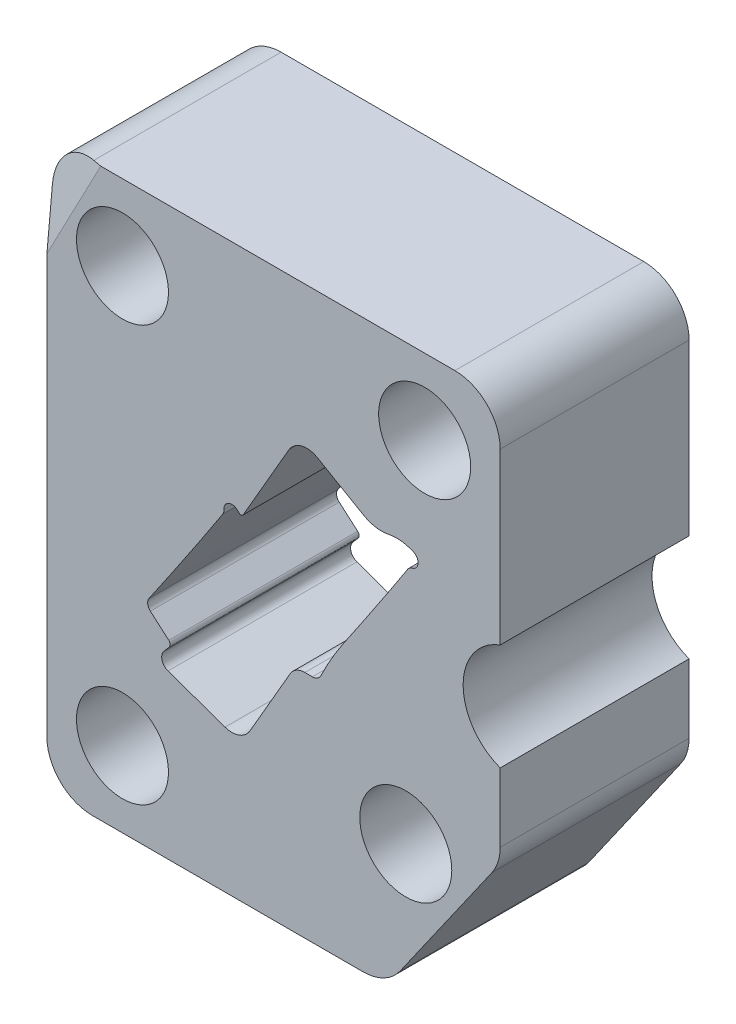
SolidWorks part; units mm, degrees
ref_plane "Front" through (0, 0, 0) normal (0, 0, 1) x (1, 0, 0)
ref_plane "Top" through (0, 0, 0) normal (0, 1, 0) x (1, 0, 0)
ref_plane "Right" through (0, 0, 0) normal (1, 0, 0) x (0, 0, -1)
ref_plane "Plane1"
sketch "Sketch1" plane through (0, 0, 0) normal (0, 0, 1) x (1, 0, 0)
  line L0 (-1085.85, 39.8243) -> (-1085.85, -16.9643) construction
  line L1 (-1116.33, 59.055) -> (-1055.37, 59.055)
  line L2 (-1123.95, 51.435) -> (-1123.95, -28.575)
  line L3 (-1116.33, -36.195) -> (-1070.8035, -36.195)
  line L4 (-1047.75, 51.435) -> (-1047.75, -6.5337)
  line L5 (-1071.9787, 11.43) -> (-1099.3643, 11.43) construction
  line L6 (-1095.375, -85.471) -> (-1095.375, 85.471) construction
  line L7 (-1055.624, 0) -> (-1095.375, 0) construction
  line L8 (-1035.177, 120.015) -> (-1035.177, 46.355) construction
  line L10 (-1064.5615, -32.9457) -> (-1049.1281, -10.9044)
  arc A0 (-1055.37, 59.055) -> (-1047.75, 51.435) centre (-1055.37, 51.435) cw
  arc A1 (-1123.95, -28.575) -> (-1116.33, -36.195) centre (-1116.33, -28.575) ccw
  arc A2 (-1116.33, 59.055) -> (-1123.95, 51.435) centre (-1116.33, 51.435) ccw
  arc A4 (-1047.75, -6.5337) -> (-1049.1281, -10.9044) centre (-1055.37, -6.5337) cw
  arc A5 (-1064.5615, -32.9457) -> (-1070.8035, -36.195) centre (-1070.8035, -28.575) cw
  point P8 (-1085.85, 11.43)
  point P18 (-1047.75, 59.055)
  point P25 (-1047.75, -36.195)
extrude "Boss-Extrude1" add sketch "Sketch1" against normal blind 31.75 flip side to cut
ref_plane "Plane2 QU250515L_Punch5[Mounted in the strip]-2"
ref_plane "Plane1 QU250515L_Punch5[Mounted in the strip]-2"
sketch "Sketch2 QU250515L_Punch5[Mounted in the strip]-2" plane through (0, 0, 0) normal (0, 0, 1) x (1, 0, 0)
  line L0 (-1080.5961, 2.8111) -> (-1079.3261, 2.8111)
  line L1 (-1090.0893, -10.4567) -> (-1083.3457, 1.2236)
  line L2 (-1103.4859, -8.4829) -> (-1093.8944, -11.8636)
  line L3 (-1103.1527, -5.4507) -> (-1104.0226, -6.4524)
  line L4 (-1106.3539, -1.325) -> (-1103.2536, -4.0174)
  line L5 (-1091.8285, 19.9313) -> (-1092.2112, 20.2654)
  line L6 (-1083.0064, 33.3938) -> (-1090.6675, 20.1244)
  line L7 (-1070.8651, 30.0502) -> (-1078.6693, 34.5559)
  line L8 (-1062.5436, 28.9295) -> (-1063.0227, 29.0983)
  line L9 (-1062.5436, 28.9295) -> (-1063.0227, 29.0983)
  line L10 (-1070.8651, 30.0502) -> (-1078.6693, 34.5559)
  line L11 (-1083.0064, 33.3938) -> (-1090.6675, 20.1244)
  line L12 (-1091.8285, 19.9313) -> (-1092.2112, 20.2654)
  line L13 (-1106.3539, -1.325) -> (-1103.2536, -4.0174)
  line L14 (-1103.1527, -5.4507) -> (-1104.0226, -6.4524)
  line L15 (-1103.4859, -8.4829) -> (-1093.8944, -11.8636)
  line L16 (-1090.0893, -10.4567) -> (-1083.3457, 1.2236)
  line L17 (-1080.5961, 2.8111) -> (-1079.3261, 2.8111)
  arc A0 (-1080.5961, 2.8111) -> (-1083.3457, 1.2236) centre (-1080.5961, -0.3639) ccw
  arc A1 (-1093.8944, -11.8636) -> (-1090.0893, -10.4567) centre (-1092.8389, -8.8692) ccw
  arc A2 (-1104.0226, -6.4524) -> (-1103.4859, -8.4829) centre (-1103.0637, -7.2851) ccw
  arc A3 (-1103.1527, -5.4507) -> (-1103.2536, -4.0174) centre (-1103.9198, -4.7845) ccw
  arc A4 (-1106.5212, -0.0019) -> (-1106.3539, -1.325) centre (-1105.6982, -0.57) ccw
  arc A5 (-1106.5212, -0.0019) -> (-1094.1094, 18.4881) centre (-1812.9205, 487.596) ccw
  arc A6 (-1094.1094, 18.4881) -> (-1093.866, 19.4364) centre (-1095.3856, 19.321) ccw
  arc A7 (-1092.2112, 20.2654) -> (-1093.866, 19.4364) centre (-1092.8689, 19.5121) ccw
  arc A8 (-1091.8285, 19.9313) -> (-1090.6675, 20.1244) centre (-1091.3274, 20.5054) ccw
  arc A9 (-1078.6693, 34.5559) -> (-1083.0064, 33.3938) centre (-1080.2568, 31.8063) ccw
  arc A10 (-1070.8651, 30.0502) -> (-1066.4119, 29.3295) centre (-1067.6901, 35.5495) ccw
  arc A11 (-1063.0227, 29.0983) -> (-1066.4119, 29.3295) centre (-1065.1336, 23.1095) ccw
  arc A12 (-1062.6359, 27.0156) -> (-1062.5436, 28.9295) centre (-1062.876, 27.9863) ccw
  arc A13 (-1062.6359, 27.0156) -> (-1063.5477, 26.3667) centre (-1062.2699, 25.5362) ccw
  arc A14 (-1074.4508, 10.0107) -> (-1063.5477, 26.3667) centre (-1773.1695, 487.596) ccw
  arc A15 (-1074.4508, 10.0107) -> (-1078.1838, 3.526) centre (-1030.0901, -19.8428) ccw
  arc A16 (-1079.3261, 2.8111) -> (-1078.1838, 3.526) centre (-1079.3261, 4.0811) ccw
  arc A17 (-1079.3261, 2.8111) -> (-1078.1838, 3.526) centre (-1079.3261, 4.0811) ccw
  arc A18 (-1074.4508, 10.0107) -> (-1078.1838, 3.526) centre (-1030.0901, -19.8428) ccw
  arc A19 (-1074.4508, 10.0107) -> (-1063.5477, 26.3667) centre (-1773.1695, 487.596) ccw
  arc A20 (-1062.6359, 27.0156) -> (-1063.5477, 26.3667) centre (-1062.2699, 25.5362) ccw
  arc A21 (-1062.6359, 27.0156) -> (-1062.5436, 28.9295) centre (-1062.876, 27.9863) ccw
  arc A22 (-1063.0227, 29.0983) -> (-1066.4119, 29.3295) centre (-1065.1336, 23.1095) ccw
  arc A23 (-1070.8651, 30.0502) -> (-1066.4119, 29.3295) centre (-1067.6901, 35.5495) ccw
  arc A24 (-1078.6693, 34.5559) -> (-1083.0064, 33.3938) centre (-1080.2568, 31.8063) ccw
  arc A25 (-1091.8285, 19.9313) -> (-1090.6675, 20.1244) centre (-1091.3274, 20.5054) ccw
  arc A26 (-1092.2112, 20.2654) -> (-1093.866, 19.4364) centre (-1092.8689, 19.5121) ccw
  arc A27 (-1094.1094, 18.4881) -> (-1093.866, 19.4364) centre (-1095.3856, 19.321) ccw
  arc A28 (-1106.5212, -0.0019) -> (-1094.1094, 18.4881) centre (-1812.9205, 487.596) ccw
  arc A29 (-1106.5212, -0.0019) -> (-1106.3539, -1.325) centre (-1105.6982, -0.57) ccw
  arc A30 (-1103.1527, -5.4507) -> (-1103.2536, -4.0174) centre (-1103.9198, -4.7845) ccw
  arc A31 (-1104.0226, -6.4524) -> (-1103.4859, -8.4829) centre (-1103.0637, -7.2851) ccw
  arc A32 (-1093.8944, -11.8636) -> (-1090.0893, -10.4567) centre (-1092.8389, -8.8692) ccw
  arc A33 (-1080.5961, 2.8111) -> (-1083.3457, 1.2236) centre (-1080.5961, -0.3639) ccw
  circle A34 centre (-1076.325, 25.4) radius 1.2065
  circle A35 centre (-1082.675, 17.4625) radius 5.3594
  circle A36 centre (-1090.6125, 3.175) radius 5.3594
  circle A52 centre (-1076.325, 25.4) radius 1.2065
  circle A56 centre (-1090.6125, 3.175) radius 5.3594
  circle A57 centre (-1082.675, 17.4625) radius 5.3594
sketch "Sketch1 QU250515L_Punch5[Mounted in the strip]-2" plane through (0, 0, -4.7625) normal (0, 0, 1) x (1, 0, 0)
  line L9 (-1080.5961, 2.491) -> (-1079.3261, 2.491)
  line L10 (-1062.4372, 29.2313) -> (-1062.9163, 29.4002)
  line L11 (-1070.7051, 30.3274) -> (-1078.5092, 34.8331)
  line L12 (-1083.2835, 33.5538) -> (-1090.9447, 20.2844)
  line L13 (-1091.6181, 20.1724) -> (-1092.0008, 20.5065)
  line L14 (-1106.5637, -1.5666) -> (-1103.4635, -4.259)
  line L15 (-1103.3943, -5.2408) -> (-1104.2643, -6.2426)
  line L16 (-1103.5923, -8.7848) -> (-1094.0008, -12.1655)
  line L17 (-1089.8122, -10.6167) -> (-1083.0686, 1.0635)
  line L18 (-1080.5961, 2.491) -> (-1079.3261, 2.491)
  line L19 (-1062.4372, 29.2313) -> (-1062.9163, 29.4002)
  line L20 (-1070.7051, 30.3274) -> (-1078.5092, 34.8331)
  line L21 (-1083.2835, 33.5538) -> (-1090.9447, 20.2844)
  line L22 (-1091.6181, 20.1724) -> (-1092.0008, 20.5065)
  line L23 (-1106.5637, -1.5666) -> (-1103.4635, -4.259)
  line L24 (-1103.3943, -5.2408) -> (-1104.2643, -6.2426)
  line L25 (-1103.5923, -8.7848) -> (-1094.0008, -12.1655)
  line L26 (-1089.8122, -10.6167) -> (-1083.0686, 1.0635)
  arc A17 (-1079.3261, 2.491) -> (-1077.896, 3.3861) centre (-1079.3261, 4.0811) ccw
  arc A18 (-1074.186, 9.8311) -> (-1077.896, 3.3861) centre (-1030.0901, -19.8428) ccw
  arc A19 (-1074.186, 9.8311) -> (-1063.2794, 26.1923) centre (-1773.1695, 487.596) ccw
  arc A20 (-1062.559, 26.7049) -> (-1063.2794, 26.1923) centre (-1062.2699, 25.5362) ccw
  arc A21 (-1062.559, 26.7049) -> (-1062.4372, 29.2313) centre (-1062.876, 27.9863) ccw
  arc A22 (-1062.9163, 29.4002) -> (-1066.4763, 29.643) centre (-1065.1336, 23.1095) ccw
  arc A23 (-1070.7051, 30.3274) -> (-1066.4763, 29.643) centre (-1067.6901, 35.5495) ccw
  arc A24 (-1078.5092, 34.8331) -> (-1083.2835, 33.5538) centre (-1080.2568, 31.8063) ccw
  arc A25 (-1091.6181, 20.1724) -> (-1090.9447, 20.2844) centre (-1091.3274, 20.5054) ccw
  arc A26 (-1092.0008, 20.5065) -> (-1094.1851, 19.4121) centre (-1092.8689, 19.5121) ccw
  arc A27 (-1094.3774, 18.663) -> (-1094.1851, 19.4121) centre (-1095.3856, 19.321) ccw
  arc A28 (-1106.7846, 0.1799) -> (-1094.3774, 18.663) centre (-1812.9205, 487.596) ccw
  arc A29 (-1106.7846, 0.1799) -> (-1106.5637, -1.5666) centre (-1105.6982, -0.57) ccw
  arc A30 (-1103.3943, -5.2408) -> (-1103.4635, -4.259) centre (-1103.9198, -4.7845) ccw
  arc A31 (-1104.2643, -6.2426) -> (-1103.5923, -8.7848) centre (-1103.0637, -7.2851) ccw
  arc A32 (-1094.0008, -12.1655) -> (-1089.8122, -10.6167) centre (-1092.8389, -8.8692) ccw
  arc A33 (-1080.5961, 2.491) -> (-1083.0686, 1.0635) centre (-1080.5961, -0.3639) ccw
  arc A34 (-1079.3261, 2.491) -> (-1077.896, 3.3861) centre (-1079.3261, 4.0811) ccw
  arc A35 (-1074.186, 9.8311) -> (-1077.896, 3.3861) centre (-1030.0901, -19.8428) ccw
  arc A36 (-1074.186, 9.8311) -> (-1063.2794, 26.1923) centre (-1773.1695, 487.596) ccw
  arc A37 (-1062.559, 26.7049) -> (-1063.2794, 26.1923) centre (-1062.2699, 25.5362) ccw
  arc A38 (-1062.559, 26.7049) -> (-1062.4372, 29.2313) centre (-1062.876, 27.9863) ccw
  arc A39 (-1062.9163, 29.4002) -> (-1066.4763, 29.643) centre (-1065.1336, 23.1095) ccw
  arc A40 (-1070.7051, 30.3274) -> (-1066.4763, 29.643) centre (-1067.6901, 35.5495) ccw
  arc A41 (-1078.5092, 34.8331) -> (-1083.2835, 33.5538) centre (-1080.2568, 31.8063) ccw
  arc A42 (-1091.6181, 20.1724) -> (-1090.9447, 20.2844) centre (-1091.3274, 20.5054) ccw
  arc A43 (-1092.0008, 20.5065) -> (-1094.1851, 19.4121) centre (-1092.8689, 19.5121) ccw
  arc A44 (-1094.3774, 18.663) -> (-1094.1851, 19.4121) centre (-1095.3856, 19.321) ccw
  arc A45 (-1106.7846, 0.1799) -> (-1094.3774, 18.663) centre (-1812.9205, 487.596) ccw
  arc A46 (-1106.7846, 0.1799) -> (-1106.5637, -1.5666) centre (-1105.6982, -0.57) ccw
  arc A47 (-1103.3943, -5.2408) -> (-1103.4635, -4.259) centre (-1103.9198, -4.7845) ccw
  arc A48 (-1104.2643, -6.2426) -> (-1103.5923, -8.7848) centre (-1103.0637, -7.2851) ccw
  arc A49 (-1094.0008, -12.1655) -> (-1089.8122, -10.6167) centre (-1092.8389, -8.8692) ccw
  arc A50 (-1080.5961, 2.491) -> (-1083.0686, 1.0635) centre (-1080.5961, -0.3639) ccw
sketch "Sketch2" plane through (0, 0, 0) normal (0, 0, 1) x (1, 0, 0)
  arc A2 (-1047.75, 5.0221) -> (-1047.75, 22.9179) centre (-1044.448, 13.97) ccw
  circle A3 centre (-1044.448, 13.97) radius 9.5377
  dimension "D1" = 0
extrude "Cut-Extrude1" cut sketch "Sketch2" against normal through all
ref_plane "Plane2" through (-36.348, 19.0606, 199.9142) normal (0.1781, -0.0934, -0.9796) x (-0.984, -0.0169, -0.1773)
other "SurfaceCut1"
hole_wizard "Hole1" positions "Point_Sketch" profile "Profil_Sketch" counterbore size "1/4" standard "ANSI Inch"
sketch "Point_Sketch" plane through (-1124.1191, -22.56, 0) normal (0, 0, -1) x (1, 0, 0)
  point P0 (12.8691, 0.935)
  point P2 (60.4941, -8.59)
  point P4 (63.6691, -68.915)
  point P6 (12.8691, -68.915)
sketch "Profil_Sketch" plane through (-1111.25, -23.495, 0) normal (1, 0, 0) x (0, -1, 0)
  line L0 (0, 0) -> (0, 31.75)
  line L1 (0, 31.75) -> (5.1562, 31.75)
  line L3 (5.1562, 31.75) -> (5.1562, 17.526)
  line L4 (5.1562, 17.526) -> (7.7343, 17.526)
  line L5 (7.7343, 17.526) -> (7.7343, 0)
  line L7 (7.7343, 0) -> (0, 0)
  line L11 (0, -6.35) -> (0, 107.95) construction
  dimension "Diameter" = 10.3124
  dimension "Thru Hole Depth" = 31.75
  dimension "L1" = 17.526
other "usin_LS160_.375-16x1.75-SHCS<1>"
extrude "Cut-Extrude1 QU250515L_Punch5[Mounted in the strip]-2" cut sketch "Sketch1 QU250515L_Punch5[Mounted in the strip]-2" against normal through all and the other way through all
